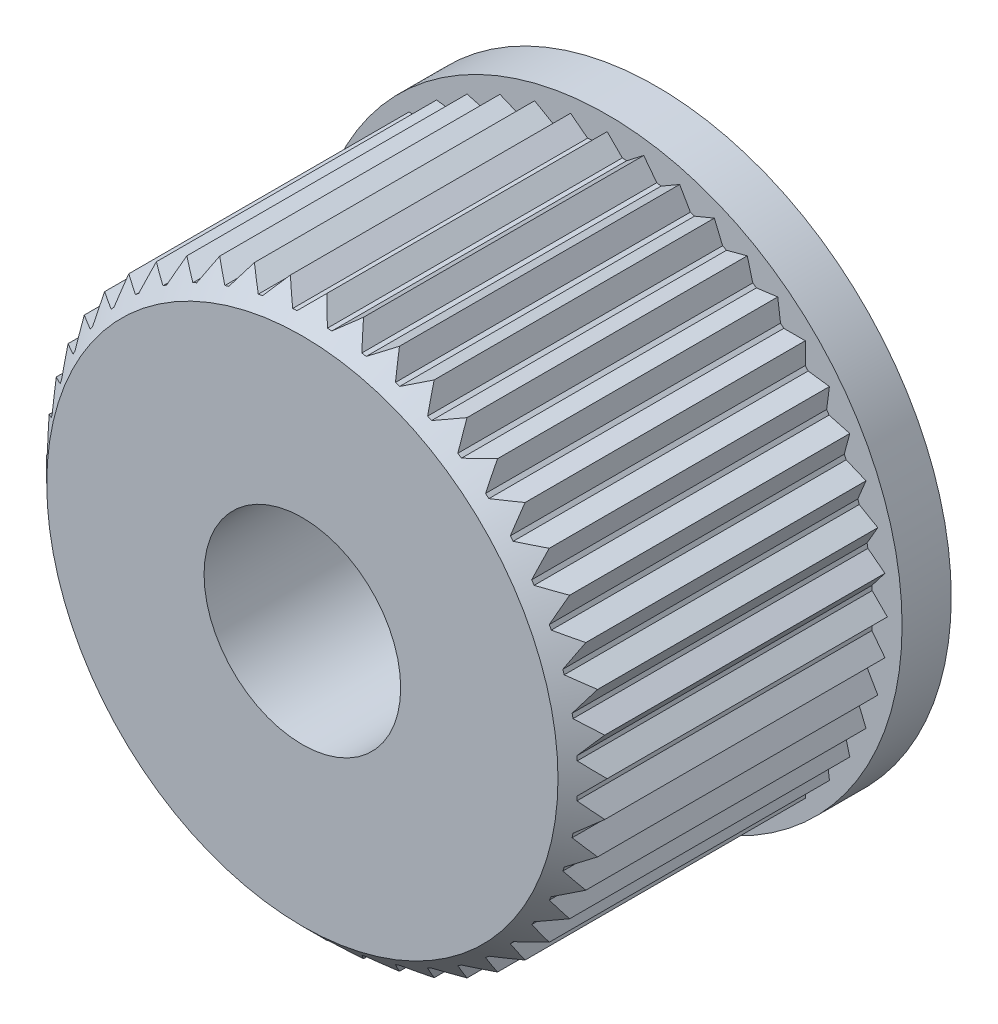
SolidWorks part; units mm, degrees
ref_plane "Plan de face" through (0, 0, 0) normal (0, 0, 1) x (1, 0, 0)
ref_plane "Plan de dessus" through (0, 0, 0) normal (0, 1, 0) x (1, 0, 0)
ref_plane "Plan de droite" through (0, 0, 0) normal (1, 0, 0) x (0, 0, -1)
sketch "Esquisse1" plane through (0, 0, 0) normal (0, 0, 1) x (1, 0, 0)
  circle A0 centre (0, 0) radius 3
  dimension "D1" = 6
extrude "Boss.-Extru.1" add sketch "Esquisse1" along normal blind 0.5
sketch "Esquisse2" plane through (0, 0, 0) normal (0, 0, 1) x (1, 0, 0)
  line L0 (0, 2.85) -> (-0.1544, 2.6956)
  line L1 (0, 2.85) -> (0.1544, 2.6956)
  line L2 (0, 2.85) -> (0, 2.7) construction
  line L3 (0.372, 2.8256) -> (0.1987, 2.6927)
  line L4 (0.372, 2.8256) -> (0.5049, 2.6524)
  line L5 (0.7376, 2.7529) -> (0.5485, 2.6437)
  line L6 (0.7376, 2.7529) -> (0.8468, 2.5638)
  line L7 (1.0906, 2.6331) -> (0.8889, 2.5495)
  line L8 (1.0906, 2.6331) -> (1.1742, 2.4313)
  line L9 (1.425, 2.4682) -> (1.2141, 2.4117)
  line L10 (1.425, 2.4682) -> (1.4815, 2.2572)
  line L11 (1.735, 2.2611) -> (1.5185, 2.2326)
  line L12 (1.735, 2.2611) -> (1.7635, 2.0445)
  line L13 (2.0153, 2.0153) -> (1.7969, 2.0153)
  line L14 (2.0153, 2.0153) -> (2.0153, 1.7969)
  line L15 (2.2611, 1.735) -> (2.0445, 1.7635)
  line L16 (2.2611, 1.735) -> (2.2326, 1.5185)
  line L17 (2.4682, 1.425) -> (2.2572, 1.4815)
  line L18 (2.4682, 1.425) -> (2.4117, 1.2141)
  line L19 (2.6331, 1.0906) -> (2.4313, 1.1742)
  line L20 (2.6331, 1.0906) -> (2.5495, 0.8889)
  line L21 (2.7529, 0.7376) -> (2.5638, 0.8468)
  line L22 (2.7529, 0.7376) -> (2.6437, 0.5485)
  line L23 (2.8256, 0.372) -> (2.6524, 0.5049)
  line L24 (2.8256, 0.372) -> (2.6927, 0.1987)
  line L25 (2.85, 0) -> (2.6956, 0.1544)
  line L26 (2.85, 0) -> (2.6956, -0.1544)
  line L27 (2.8256, -0.372) -> (2.6927, -0.1987)
  line L28 (2.8256, -0.372) -> (2.6524, -0.5049)
  line L29 (2.7529, -0.7376) -> (2.6437, -0.5485)
  line L30 (2.7529, -0.7376) -> (2.5638, -0.8468)
  line L31 (2.6331, -1.0906) -> (2.5495, -0.8889)
  line L32 (2.6331, -1.0906) -> (2.4313, -1.1742)
  line L33 (2.4682, -1.425) -> (2.4117, -1.2141)
  line L34 (2.4682, -1.425) -> (2.2572, -1.4815)
  line L35 (2.2611, -1.735) -> (2.2326, -1.5185)
  line L36 (2.2611, -1.735) -> (2.0445, -1.7635)
  line L37 (2.0153, -2.0153) -> (2.0153, -1.7969)
  line L38 (2.0153, -2.0153) -> (1.7969, -2.0153)
  line L39 (1.735, -2.2611) -> (1.7635, -2.0445)
  line L40 (1.735, -2.2611) -> (1.5185, -2.2326)
  line L41 (1.425, -2.4682) -> (1.4815, -2.2572)
  line L42 (1.425, -2.4682) -> (1.2141, -2.4117)
  line L43 (1.0906, -2.6331) -> (1.1742, -2.4313)
  line L44 (1.0906, -2.6331) -> (0.8889, -2.5495)
  line L45 (0.7376, -2.7529) -> (0.8468, -2.5638)
  line L46 (0.7376, -2.7529) -> (0.5485, -2.6437)
  line L47 (0.372, -2.8256) -> (0.5049, -2.6524)
  line L48 (0.372, -2.8256) -> (0.1987, -2.6927)
  line L49 (0, -2.85) -> (0.1544, -2.6956)
  line L50 (0, -2.85) -> (-0.1544, -2.6956)
  line L51 (-0.372, -2.8256) -> (-0.1987, -2.6927)
  line L52 (-0.372, -2.8256) -> (-0.5049, -2.6524)
  line L53 (-0.7376, -2.7529) -> (-0.5485, -2.6437)
  line L54 (-0.7376, -2.7529) -> (-0.8468, -2.5638)
  line L55 (-1.0906, -2.6331) -> (-0.8889, -2.5495)
  line L56 (-1.0906, -2.6331) -> (-1.1742, -2.4313)
  line L57 (-1.425, -2.4682) -> (-1.2141, -2.4117)
  line L58 (-1.425, -2.4682) -> (-1.4815, -2.2572)
  line L59 (-1.735, -2.2611) -> (-1.5185, -2.2326)
  line L60 (-1.735, -2.2611) -> (-1.7635, -2.0445)
  line L61 (-2.0153, -2.0153) -> (-1.7969, -2.0153)
  line L62 (-2.0153, -2.0153) -> (-2.0153, -1.7969)
  line L63 (-2.2611, -1.735) -> (-2.0445, -1.7635)
  line L64 (-2.2611, -1.735) -> (-2.2326, -1.5185)
  line L65 (-2.4682, -1.425) -> (-2.2572, -1.4815)
  line L66 (-2.4682, -1.425) -> (-2.4117, -1.2141)
  line L67 (-2.6331, -1.0906) -> (-2.4313, -1.1742)
  line L68 (-2.6331, -1.0906) -> (-2.5495, -0.8889)
  line L69 (-2.7529, -0.7376) -> (-2.5638, -0.8468)
  line L70 (-2.7529, -0.7376) -> (-2.6437, -0.5485)
  line L71 (-2.8256, -0.372) -> (-2.6524, -0.5049)
  line L72 (-2.8256, -0.372) -> (-2.6927, -0.1987)
  line L73 (-2.85, 0) -> (-2.6956, -0.1544)
  line L74 (-2.85, 0) -> (-2.6956, 0.1544)
  line L75 (-2.8256, 0.372) -> (-2.6927, 0.1987)
  line L76 (-2.8256, 0.372) -> (-2.6524, 0.5049)
  line L77 (-2.7529, 0.7376) -> (-2.6437, 0.5485)
  line L78 (-2.7529, 0.7376) -> (-2.5638, 0.8468)
  line L79 (-2.6331, 1.0906) -> (-2.5495, 0.8889)
  line L80 (-2.6331, 1.0906) -> (-2.4313, 1.1742)
  line L81 (-2.4682, 1.425) -> (-2.4117, 1.2141)
  line L82 (-2.4682, 1.425) -> (-2.2572, 1.4815)
  line L83 (-2.2611, 1.735) -> (-2.2326, 1.5185)
  line L84 (-2.2611, 1.735) -> (-2.0445, 1.7635)
  line L85 (-2.0153, 2.0153) -> (-2.0153, 1.7969)
  line L86 (-2.0153, 2.0153) -> (-1.7969, 2.0153)
  line L87 (-1.735, 2.2611) -> (-1.7635, 2.0445)
  line L88 (-1.735, 2.2611) -> (-1.5185, 2.2326)
  line L89 (-1.425, 2.4682) -> (-1.4815, 2.2572)
  line L90 (-1.425, 2.4682) -> (-1.2141, 2.4117)
  line L91 (-1.0906, 2.6331) -> (-1.1742, 2.4313)
  line L92 (-1.0906, 2.6331) -> (-0.8889, 2.5495)
  line L93 (-0.7376, 2.7529) -> (-0.8468, 2.5638)
  line L94 (-0.7376, 2.7529) -> (-0.5485, 2.6437)
  line L95 (-0.372, 2.8256) -> (-0.5049, 2.6524)
  line L96 (-0.372, 2.8256) -> (-0.1987, 2.6927)
  circle A0 centre (0, 0) radius 2.85 construction
  circle A1 centre (0, 0) radius 2.7 construction
  arc A2 (2.6956, 0.1544) -> (2.6927, 0.1987) centre (0, 0) ccw
  arc A3 (2.6524, 0.5049) -> (2.6437, 0.5485) centre (0, 0) ccw
  arc A4 (2.5638, 0.8468) -> (2.5495, 0.8889) centre (0, 0) ccw
  arc A5 (2.4313, 1.1742) -> (2.4117, 1.2141) centre (0, 0) ccw
  arc A6 (2.2572, 1.4815) -> (2.2326, 1.5185) centre (0, 0) ccw
  arc A7 (2.0445, 1.7635) -> (2.0153, 1.7969) centre (0, 0) ccw
  arc A8 (1.7969, 2.0153) -> (1.7635, 2.0445) centre (0, 0) ccw
  arc A9 (1.5185, 2.2326) -> (1.4815, 2.2572) centre (0, 0) ccw
  arc A10 (1.2141, 2.4117) -> (1.1742, 2.4313) centre (0, 0) ccw
  arc A11 (0.8889, 2.5495) -> (0.8468, 2.5638) centre (0, 0) ccw
  arc A12 (0.5485, 2.6437) -> (0.5049, 2.6524) centre (0, 0) ccw
  arc A13 (0.1987, 2.6927) -> (0.1544, 2.6956) centre (0, 0) ccw
  arc A14 (-0.1544, 2.6956) -> (-0.1987, 2.6927) centre (0, 0) ccw
  arc A15 (-0.5049, 2.6524) -> (-0.5485, 2.6437) centre (0, 0) ccw
  arc A16 (-0.8468, 2.5638) -> (-0.8889, 2.5495) centre (0, 0) ccw
  arc A17 (-1.1742, 2.4313) -> (-1.2141, 2.4117) centre (0, 0) ccw
  arc A18 (-1.4815, 2.2572) -> (-1.5185, 2.2326) centre (0, 0) ccw
  arc A19 (-1.7635, 2.0445) -> (-1.7969, 2.0153) centre (0, 0) ccw
  arc A20 (-2.0153, 1.7969) -> (-2.0445, 1.7635) centre (0, 0) ccw
  arc A21 (-2.2326, 1.5185) -> (-2.2572, 1.4815) centre (0, 0) ccw
  arc A22 (-2.4117, 1.2141) -> (-2.4313, 1.1742) centre (0, 0) ccw
  arc A23 (-2.5495, 0.8889) -> (-2.5638, 0.8468) centre (0, 0) ccw
  arc A24 (-2.6437, 0.5485) -> (-2.6524, 0.5049) centre (0, 0) ccw
  arc A25 (-2.6927, 0.1987) -> (-2.6956, 0.1544) centre (0, 0) ccw
  arc A26 (-2.6956, -0.1544) -> (-2.6927, -0.1987) centre (0, 0) ccw
  arc A27 (-2.6524, -0.5049) -> (-2.6437, -0.5485) centre (0, 0) ccw
  arc A28 (-2.5638, -0.8468) -> (-2.5495, -0.8889) centre (0, 0) ccw
  arc A29 (-2.4313, -1.1742) -> (-2.4117, -1.2141) centre (0, 0) ccw
  arc A30 (-2.2572, -1.4815) -> (-2.2326, -1.5185) centre (0, 0) ccw
  arc A31 (-2.0445, -1.7635) -> (-2.0153, -1.7969) centre (0, 0) ccw
  arc A32 (-1.7969, -2.0153) -> (-1.7635, -2.0445) centre (0, 0) ccw
  arc A33 (-1.5185, -2.2326) -> (-1.4815, -2.2572) centre (0, 0) ccw
  arc A34 (-1.2141, -2.4117) -> (-1.1742, -2.4313) centre (0, 0) ccw
  arc A35 (-0.8889, -2.5495) -> (-0.8468, -2.5638) centre (0, 0) ccw
  arc A36 (-0.5485, -2.6437) -> (-0.5049, -2.6524) centre (0, 0) ccw
  arc A37 (-0.1987, -2.6927) -> (-0.1544, -2.6956) centre (0, 0) ccw
  arc A38 (0.1544, -2.6956) -> (0.1987, -2.6927) centre (0, 0) ccw
  arc A39 (0.5049, -2.6524) -> (0.5485, -2.6437) centre (0, 0) ccw
  arc A40 (0.8468, -2.5638) -> (0.8889, -2.5495) centre (0, 0) ccw
  arc A41 (1.1742, -2.4313) -> (1.2141, -2.4117) centre (0, 0) ccw
  arc A42 (1.4815, -2.2572) -> (1.5185, -2.2326) centre (0, 0) ccw
  arc A43 (1.7635, -2.0445) -> (1.7969, -2.0153) centre (0, 0) ccw
  arc A44 (2.0153, -1.7969) -> (2.0445, -1.7635) centre (0, 0) ccw
  arc A45 (2.2326, -1.5185) -> (2.2572, -1.4815) centre (0, 0) ccw
  arc A46 (2.6927, -0.1987) -> (2.6956, -0.1544) centre (0, 0) ccw
  arc A47 (2.6437, -0.5485) -> (2.6524, -0.5049) centre (0, 0) ccw
  arc A48 (2.5495, -0.8889) -> (2.5638, -0.8468) centre (0, 0) ccw
  arc A49 (2.4117, -1.2141) -> (2.4313, -1.1742) centre (0, 0) ccw
  dimension "D1" = 5.7
  dimension "D2" = 5.4
  dimension "D3" = 135
  dimension "D4" = 45
  dimension "D5" = 48
extrude "Boss.-Extru.2" add sketch "Esquisse2" along normal blind 3.6
sketch "Esquisse3" plane through (0, 0, 3.6) normal (0, 0, 1) x (1, 0, 0)
  circle A0 centre (0, 0) radius 1
  dimension "D1" = 2
extrude "Enlèv. mat.-Extru.1" cut sketch "Esquisse3" against normal through all
sketch "Esquisse4" plane through (0, 0, 0) normal (1, 0, 0) x (0, 0, -1)
  line L0 (-3.6, 2.6) -> (-3.2, 3)
  line L1 (-3.2, 3) -> (-3.6, 3)
  line L2 (-3.6, 3) -> (-3.6, 2.6)
  line L3 (0, 0) -> (-4.2865, 0) construction
  line L4 (0, 3) -> (-0.5, 3) construction
  line L5 (-3.6, 2.0445) -> (-3.6, 2.2611) construction
  dimension "D1" = 2.6
  dimension "D2" = 45
revolve "Enlèvement de matière-Révolution1" cut sketch "Esquisse4" angle 360 about L3
